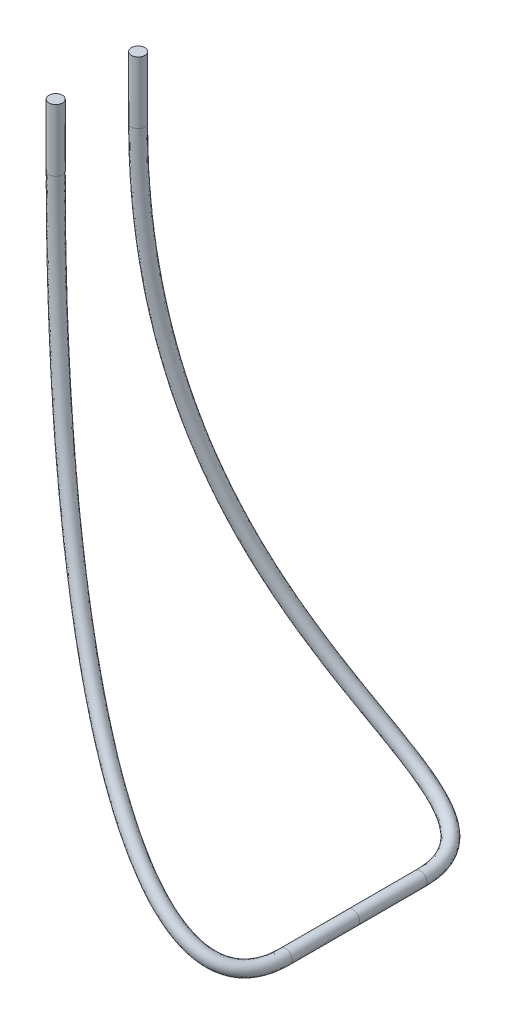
SolidWorks part; units mm, degrees
ref_plane "Front Plane" through (0, 0, 0) normal (0, 0, 1) x (1, 0, 0)
ref_plane "Top Plane" through (0, 0, 0) normal (0, 1, 0) x (1, 0, 0)
ref_plane "Right Plane" through (0, 0, 0) normal (1, 0, 0) x (0, 0, -1)
sketch3d "3DSketch1"
  line L0 (-24.13, 264.9582, 3.8846) -> (-24.13, 259.1014, 3.8846)
  line L1 (0, 208.28, 6.35) -> (0, 208.28, 0)
  line L4 (0, 208.28, 4.8344) -> (0, 208.28, 5.8199) construction
  line L5 (0, 259.08, 0) -> (0, 8.255, 0) construction
  spline S1 degree 3 poles (-24.13, 259.1014, 3.8846) (-24.13, 217.0776, 3.8846) (0, 208.28, 20.0254) (0, 208.28, 6.35) knots 0 0 0 0 1 1 1 1
sketch "Sketch2" plane through (0, 0, 0) normal (0, 0, 1) x (1, 0, 0)
  circle A0 centre (0, 208.28) radius 0.635
  dimension "D1" = 1.27
sweep "Sweep1" add profiles "Sketch2" path "3DSketch1"
mirror "Mirror1" about plane through (0, 0, 0) normal (0, 0, 1)
